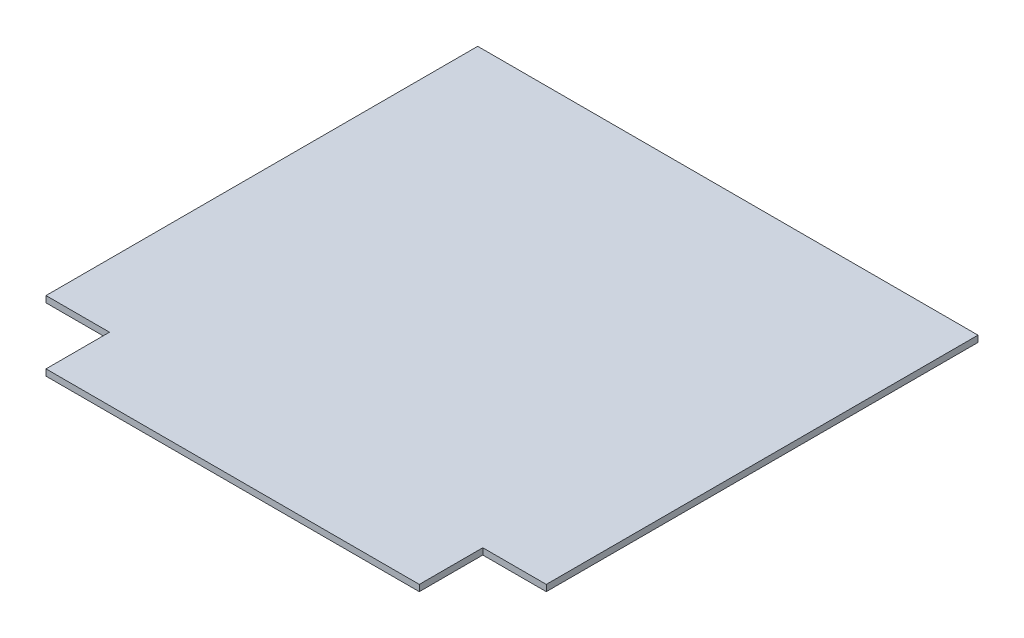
SolidWorks part; units mm, degrees
ref_plane "Front Plane" through (0, 0, 0) normal (0, 0, 1) x (1, 0, 0)
ref_plane "Top Plane" through (0, 0, 0) normal (0, 1, 0) x (1, 0, 0)
ref_plane "Right Plane" through (0, 0, 0) normal (1, 0, 0) x (0, 0, -1)
sketch "Sketch1" plane through (0, 0, 0) normal (0, 1, 0) x (1, 0, 0)
  line L1 (-153.4823, 195.8233) -> (240.5177, 195.8233)
  line L2 (-153.4823, 195.8233) -> (-153.4823, -194.1767)
  line L3 (-153.4823, -194.1767) -> (240.5177, -194.1767)
  line L4 (240.5177, 195.8233) -> (240.5177, -194.1767)
  line L5 (-153.4823, 195.8233) -> (240.5177, -194.1767) construction
  line L6 (-153.4823, -194.1767) -> (240.5177, 195.8233) construction
  line L7 (-153.4823, -194.1767) -> (-103.4823, -194.1767)
  line L8 (-153.4823, -194.1767) -> (-153.4823, -144.1767)
  line L9 (-153.4823, -144.1767) -> (-103.4823, -144.1767)
  line L10 (-103.4823, -194.1767) -> (-103.4823, -144.1767)
  line L11 (-153.4823, -194.1767) -> (-103.4823, -144.1767) construction
  line L12 (-153.4823, -144.1767) -> (-103.4823, -194.1767) construction
  line L13 (240.5177, -194.1767) -> (190.5177, -194.1767)
  line L14 (240.5177, -194.1767) -> (240.5177, -144.1767)
  line L15 (240.5177, -144.1767) -> (190.5177, -144.1767)
  line L16 (190.5177, -194.1767) -> (190.5177, -144.1767)
  line L17 (240.5177, -194.1767) -> (190.5177, -144.1767) construction
  line L18 (240.5177, -144.1767) -> (190.5177, -194.1767) construction
  point P4 (43.5177, 0.8233)
  point P8 (-128.4823, -169.1767)
  point P12 (215.5177, -169.1767)
  dimension "D1" = 390
  dimension "D2" = 394
  dimension "D3" = 50
  dimension "D4" = 50
  dimension "D5" = 294
extrude "Boss-Extrude1" add sketch "Sketch1" along normal blind 5 contours L3 L16 L15 L4 L1 L2 L9 L10
